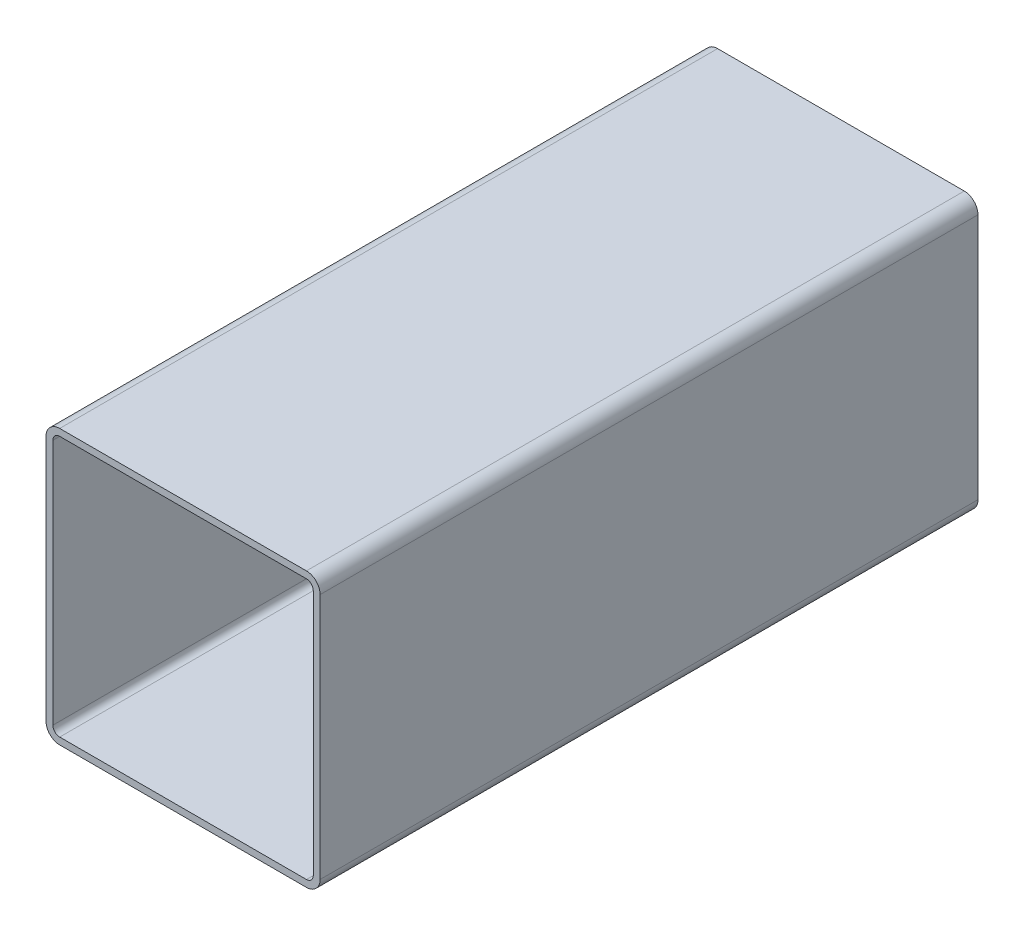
SolidWorks part; units mm, degrees
ref_plane "Front Plane" through (0, 0, 0) normal (0, 0, 1) x (1, 0, 0)
ref_plane "Top Plane" through (0, 0, 0) normal (0, 1, 0) x (1, 0, 0)
ref_plane "Right Plane" through (0, 0, 0) normal (1, 0, 0) x (0, 0, -1)
sketch "Sketch1" plane through (0, 0, 0) normal (0, 0, 1) x (1, 0, 0)
sketch_block_instance "HSS5x5x0.125-1"
sketch_block "HSS5x5x0.125"
extrude "Boss-Extrude1" add sketch "Sketch1" along normal blind 304.8
